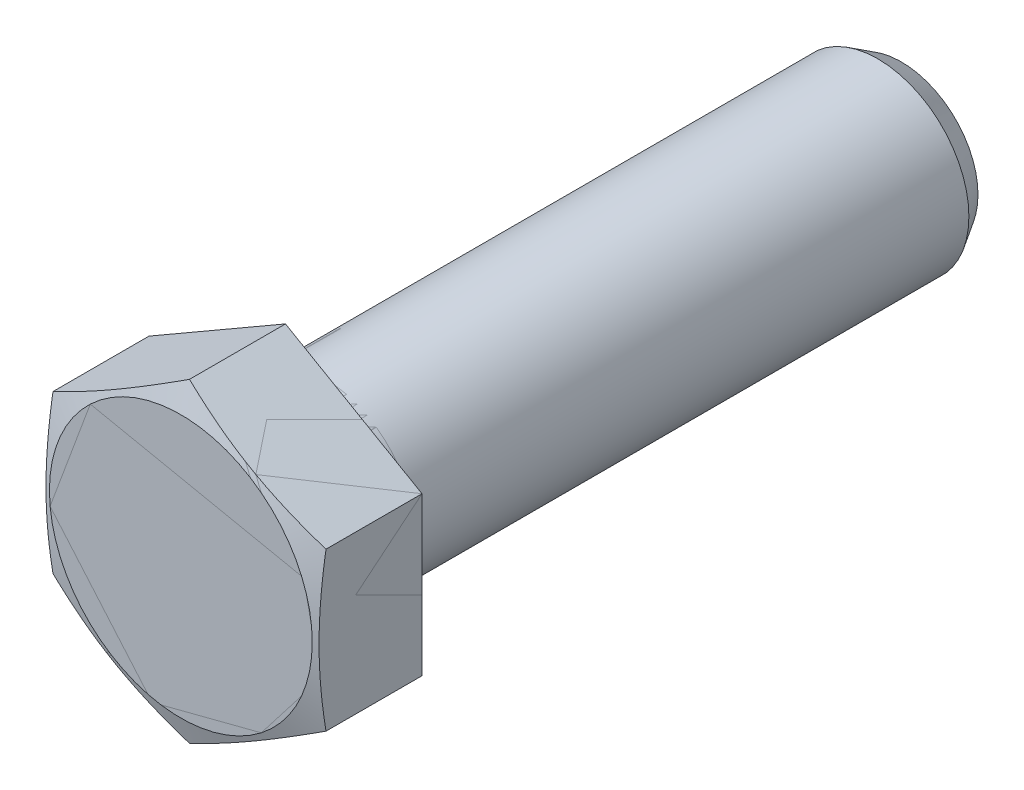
SolidWorks part; units mm, degrees
ref_plane "Face" through (0, 0, 0) normal (0, 0, 1) x (1, 0, 0)
ref_plane "Dessus" through (0, 0, 0) normal (0, 1, 0) x (1, 0, 0)
ref_plane "Droite" through (0, 0, 0) normal (1, 0, 0) x (0, 0, -1)
imported_body "Vis H M12-40 - 4,6, Grade A, type 2 - NF E 25-114"
sketch "Esquisse1" plane through (0, 0, -3.6) normal (0, 0, 1) x (1, 0, 0)
  circle A0 centre (0, 0) radius 6 construction
  circle A1 centre (0, 0) radius 6
extrude "Boss.-Extru.1" add sketch "Esquisse1" along normal up to next
